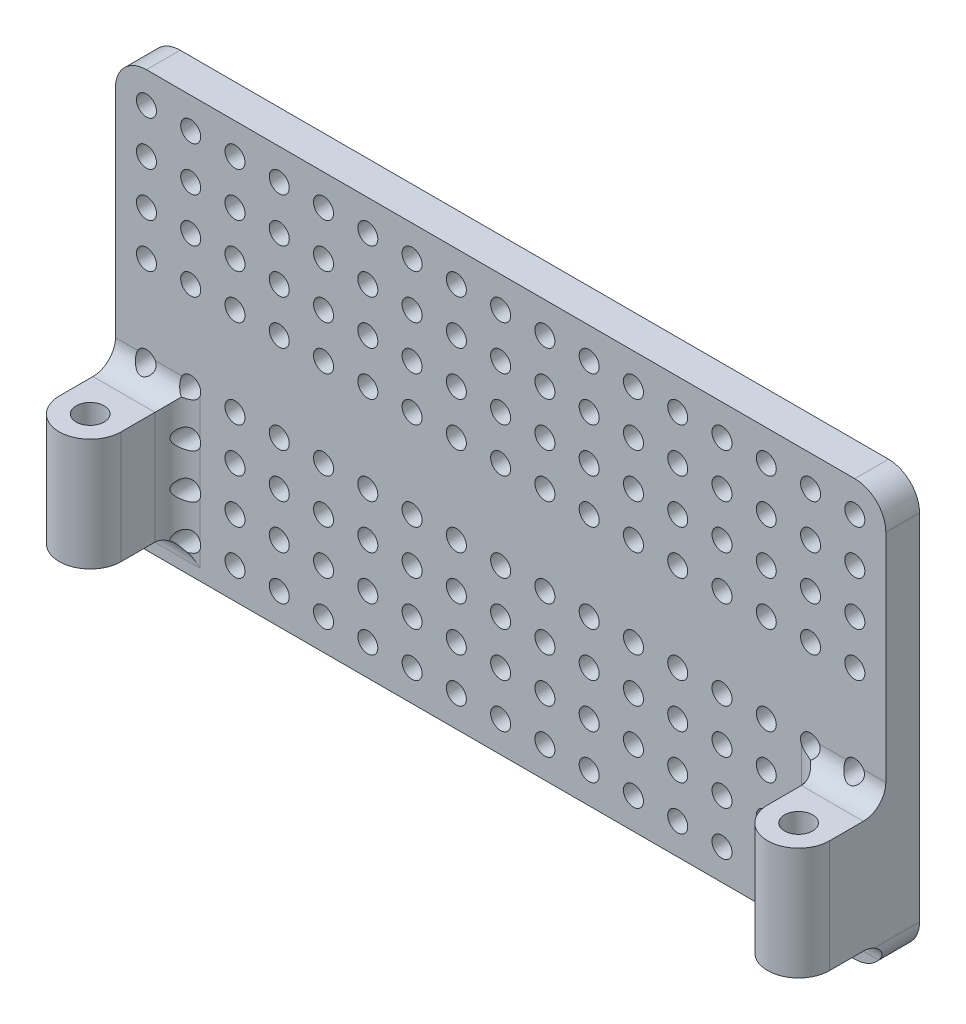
SolidWorks part; units mm, degrees
ref_plane "Front Plane" through (0, 0, 0) normal (0, 0, 1) x (1, 0, 0)
ref_plane "Top Plane" through (0, 0, 0) normal (0, 1, 0) x (1, 0, 0)
ref_plane "Right Plane" through (0, 0, 0) normal (1, 0, 0) x (0, 0, -1)
sketch "Sketch1" plane through (0, 0, 0) normal (0, 0, 1) x (1, 0, 0)
  line L1 (43.5, -23.5) -> (-43.5, -23.5)
  line L2 (43.5, -23.5) -> (43.5, 23.5)
  line L3 (43.5, 23.5) -> (-43.5, 23.5)
  line L4 (-43.5, -23.5) -> (-43.5, 23.5)
  line L5 (43.5, -23.5) -> (-43.5, 23.5) construction
  line L6 (43.5, 23.5) -> (-43.5, -23.5) construction
  point P0 (0, 0)
  dimension "D1" = 87
  dimension "D2" = 47
extrude "Boss-Extrude1" add sketch "Sketch1" along normal mid plane 3.81
ref_plane "Plane1" through (0, -19.69, 0) normal (0, -1, 0) x (-1, 0, 0)
sketch "Sketch2" plane through (0, -19.69, 0) normal (0, -1, 0) x (1, 0, 0)
  line L0 (-40, 8.255) -> (40, 8.255) construction
  line L1 (-43.5, 8.255) -> (-43.5, 1.905)
  line L2 (0, 0) -> (0, 8.255) construction
  line L3 (-43.5, 1.905) -> (-36.5, 1.905)
  line L4 (43.5, 1.905) -> (-43.5, 1.905) construction
  line L5 (-36.5, 1.905) -> (-36.5, 8.255)
  line L6 (-43.5, 1.905) -> (43.5, 1.905) construction
  line L7 (36.5, 1.905) -> (36.5, 8.255)
  line L8 (43.5, 1.905) -> (36.5, 1.905)
  line L9 (43.5, 8.255) -> (43.5, 1.905)
  arc A0 (-36.5, 8.255) -> (-43.5, 8.255) centre (-40, 8.255) ccw
  arc A1 (43.5, 8.255) -> (36.5, 8.255) centre (40, 8.255) ccw
  dimension "D2" = 7
  dimension "D3" = 6.35
  dimension "D1" = 80
extrude "Boss-Extrude2" add sketch "Sketch2" against normal blind 12.7
hole_wizard "1/8 (0.125) Diameter Hole1" positions "Sketch4" profile "Sketch5" hole size "1/8" standard "ANSI Inch"
sketch "Sketch4" plane through (0, -19.69, 0) normal (0, -1, 0) x (-1, 0, 0)
  circle A0 centre (40, -8.255) radius 3.5 construction
  circle A1 centre (-40, -8.255) radius 3.5 construction
  point P0 (40, -8.255)
  point P3 (-40, -8.255)
  point P7 (0, 0)
  point P10 (0, 0)
sketch "Sketch5" plane through (-40, -19.69, 8.255) normal (1, 0, 0) x (0, 0, -1)
  line L0 (0, 0) -> (0, 43.19)
  line L1 (0, 43.19) -> (1.5875, 43.19)
  line L2 (1.5875, 43.19) -> (1.5875, 0)
  line L5 (1.5875, 0) -> (0, 0)
  line L11 (0, -6.35) -> (0, 107.95) construction
  dimension "Thru Hole Dia." = 3.175
  dimension "Thru Hole Depth" = 43.19
fillet "Fillet5" radius 2.54 6 edges at (36.5, -13.34, 1.905) (-36.5, -13.34, 1.905) (40, -6.99, 1.905) (-40, -6.99, 1.905) (-40, -19.69, 1.905) (40, -19.69, 1.905)
fillet "Fillet7" radius 3.5 4 edges at (43.5, -23.5, 0) (-43.5, -23.5, 0) (-43.5, 23.5, 0) (43.5, 23.5, 0)
hole_wizard "#4-40 Tapped Hole3" positions "Sketch11" profile "Sketch12" tap size "#4-40" standard "ANSI Inch"
sketch "Sketch11" plane through (0, 0, -1.905) normal (0, 0, -1) x (-1, 0, 0)
  line L0 (-43.5, -20) -> (-43.5, 20) construction
  line L1 (-40, 23.5) -> (40, 23.5) construction
  point P0 (-40, 20)
  point P15 (-40, -20)
  point P22 (-40, -5)
  point P24 (-40, -10)
  point P29 (-40, 10)
  point P31 (-40, 5)
  point P35 (-40, -15)
  point P41 (-40, 15)
  point P44 (0, 0)
  dimension "D1" = 3.5
  dimension "D2" = 3.5
  dimension "D3" = 40
  dimension "D4" = 25
  dimension "D5" = 30
  dimension "D6" = 30
  dimension "D7" = 25
  dimension "D8" = 35
  dimension "D9" = 35
sketch "Sketch12" plane through (40, 20, -1.905) normal (1, 0, 0) x (0, 1, 0)
  line L0 (0, 0) -> (0, 7.0292)
  line L1 (0, 7.0292) -> (1.1303, 6.35)
  line L2 (1.1303, 6.35) -> (1.1303, 0)
  line L5 (1.1303, 0) -> (0, 0)
  line L10 (0, 7.0292) -> (-1.1303, 6.35) construction
  line L11 (0, -6.35) -> (0, 107.95) construction
  dimension "Tap Drill Dia." = 2.2606
  dimension "Tap Drill Depth" = 6.35
  dimension "Drill Angle" = 118
pattern_linear "LPattern2" count 17 spacing 5 along (-1, 0, 0) of "#4-40 Tapped Hole3"
